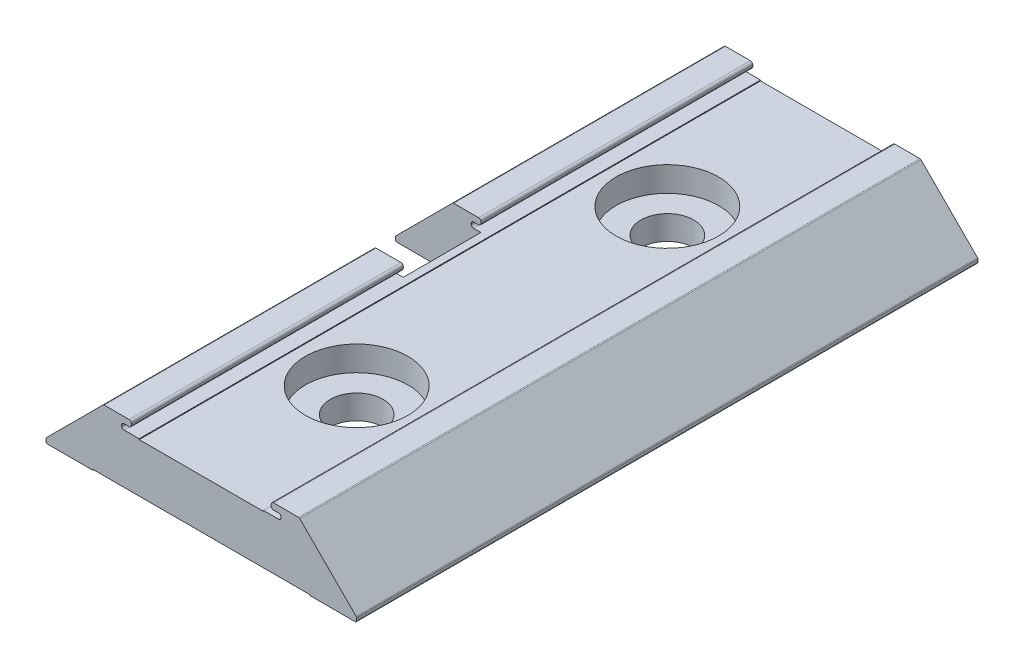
SolidWorks part; units mm, degrees
ref_plane "Front Plane" through (0, 0, 0) normal (0, 0, 1) x (1, 0, 0)
ref_plane "Top Plane" through (0, 0, 0) normal (0, 1, 0) x (1, 0, 0)
ref_plane "Right Plane" through (0, 0, 0) normal (1, 0, 0) x (0, 0, -1)
sketch "Sketch1" plane through (0, 0, 0) normal (0, 0, 1) x (1, 0, 0)
  line L0 (0.1, 0) -> (3, 0)
  line L1 (0, 0.1) -> (0, 0.2586)
  line L2 (0.0293, 0.3293) -> (3.6707, 3.9707)
  line L3 (3.7414, 4) -> (5.35, 4)
  line L4 (5.5, 3.85) -> (5.5, 3.75)
  line L5 (5.35, 3.6) -> (5.025, 3.6)
  line L6 (4.875, 3.45) -> (4.875, 3.4)
  line L7 (5.025, 3.25) -> (6, 3.25)
  line L8 (15.125, 3.4) -> (15.125, 3.45)
  line L9 (14.975, 3.6) -> (14.65, 3.6)
  line L10 (14.5, 3.75) -> (14.5, 3.85)
  line L11 (14.65, 4) -> (16.2586, 4)
  line L12 (16.3293, 3.9707) -> (19.9707, 0.3293)
  line L13 (20, 0.2586) -> (20, 0.1)
  line L14 (19.9, 0) -> (17, 0)
  line L15 (17, 0) -> (17, 0.05)
  line L16 (17, 0.05) -> (3, 0.05)
  line L17 (3, 0.05) -> (3, 0)
  line L18 (14, 3.25) -> (14.975, 3.25)
  line L19 (0, 0) -> (0.801, 0) construction
  line L20 (6, 3.25) -> (6, 3.2)
  line L21 (6, 3.2) -> (9.9, 3.2)
  line L22 (14, 3.25) -> (14, 3.2)
  line L23 (0, 0) -> (0, 0.3) construction
  line L24 (9.9, 3.2) -> (14, 3.2)
  line L25 (0, 0.3) -> (0.2634, 0.5634) construction
  arc A0 (5.025, 3.6) -> (4.875, 3.45) centre (5.025, 3.45) ccw
  arc A1 (5.025, 3.25) -> (4.875, 3.4) centre (5.025, 3.4) cw
  arc A2 (5.5, 3.75) -> (5.35, 3.6) centre (5.35, 3.75) cw
  arc A3 (5.35, 4) -> (5.5, 3.85) centre (5.35, 3.85) cw
  arc A4 (15.125, 3.4) -> (14.975, 3.25) centre (14.975, 3.4) cw
  arc A5 (14.975, 3.6) -> (15.125, 3.45) centre (14.975, 3.45) cw
  arc A6 (14.5, 3.75) -> (14.65, 3.6) centre (14.65, 3.75) ccw
  arc A7 (14.65, 4) -> (14.5, 3.85) centre (14.65, 3.85) ccw
  arc A8 (20, 0.1) -> (19.9, 0) centre (19.9, 0.1) cw
  arc A9 (19.9707, 0.3293) -> (20, 0.2586) centre (19.9, 0.2586) cw
  arc A10 (16.3293, 3.9707) -> (16.2586, 4) centre (16.2586, 3.9) ccw
  arc A11 (3.6707, 3.9707) -> (3.7414, 4) centre (3.7414, 3.9) cw
  arc A12 (0.0293, 0.3293) -> (0, 0.2586) centre (0.1, 0.2586) ccw
  arc A13 (0.1, 0) -> (0, 0.1) centre (0.1, 0.1) cw
  point P42 (20, 0)
  point P45 (20, 0.3)
  point P52 (0, 0.3)
  point P55 (0, 0)
  dimension "D17" = 0.15
  dimension "D19" = 3.2
  dimension "D24" = 0.1
  dimension "D1" = 20
  dimension "D2" = 3
  dimension "D3" = 3
  dimension "D4" = 0.3
  dimension "D5" = 0.3
  dimension "D6" = 0.05
  dimension "D7" = 4
  dimension "D8" = 4
  dimension "D9" = 10.25
  dimension "D10" = 4.875
  dimension "D11" = 0.75
  dimension "D12" = 0.35
  dimension "D13" = 0.35
  dimension "D14" = 9
  dimension "D15" = 0.625
  dimension "D16" = 135
  dimension "D18" = 4.875
  dimension "D20" = 0.625
  dimension "D21" = 8
  dimension "D22" = 6
  dimension "D23" = 0.05
extrude "Extrude1" add sketch "Sketch1" along normal blind 40
hole_wizard "CBORE for M3 Hex Socket Head Cap Screw1" positions "Sketch5" profile "Sketch4" counterbore size "M3" standard "DIN"
sketch "Sketch5" plane through (0, 3.2, 0) normal (0, 1, 0) x (-1, 0, 0)
  line L0 (-14, 0) -> (-6, 0) construction
  line L1 (0, 40) -> (0, 0) construction
  point P0 (-10, 10)
  dimension "D1" = 10
  dimension "D2" = 10
sketch "Sketch4" plane through (10, 3.2, 10) normal (1, 0, 0) x (0, 0, 1)
  line L0 (0, 0) -> (0, 3.2)
  line L1 (0, 3.2) -> (1.7, 3.2)
  line L3 (1.7, 3.2) -> (1.7, 1.6)
  line L4 (1.7, 1.6) -> (3.3, 1.6)
  line L5 (3.3, 1.6) -> (3.3, 0)
  line L7 (3.3, 0) -> (0, 0)
  line L11 (0, -6.35) -> (0, 107.95) construction
  dimension "Thru Hole Dia." = 3.4
  dimension "Thru Hole Depth" = 3.2
  dimension "C'Bore Dia." = 6.6
  dimension "C'Bore Depth" = 1.6
pattern_linear "LPattern1" count 2 spacing 20 along (0, 0, 1) of "CBORE for M3 Hex Socket Head Cap Screw1"
sketch "Sketch6" plane through (0, 0, 0) normal (-1, 0, 0) x (0, 0, 1)
  line L0 (0, 3.9707) -> (0, 0.3293) construction
  line L1 (17.5, 7.833) -> (22.5, 7.833)
  line L2 (17.5, 7.833) -> (17.5, -4.2353)
  line L3 (17.5, -4.2353) -> (22.5, -4.2353)
  line L4 (22.5, 7.833) -> (22.5, -4.2353)
  dimension "D1" = 17.5
  dimension "D2" = 5
extrude "Extrude2" cut sketch "Sketch6" against normal blind 5.5
hole_wizard "M1.6 Tapped Hole1" positions "Sketch8" profile "Sketch7" tap size "M1.6" standard "DIN"
sketch "Sketch8" plane through (5.5, 0, 0) normal (-1, 0, 0) x (0, 0, 1)
  line L0 (40, 0) -> (0, 0) construction
  line L1 (0, 3.9707) -> (0, 0.3293) construction
  point P0 (20, 1.8)
  dimension "D1" = 1.8
  dimension "D2" = 20
sketch "Sketch7" plane through (5.5, 1.8, 20) normal (0, 1, 0) x (0, 0, 1)
  line L0 (0, 0) -> (0, 6.4255)
  line L1 (0, 6.4255) -> (0.625, 6.05)
  line L2 (0.625, 6.05) -> (0.625, 0)
  line L5 (0.625, 0) -> (0, 0)
  line L10 (0, 6.4255) -> (-0.625, 6.05) construction
  line L11 (0, -6.35) -> (0, 107.95) construction
  dimension "Tap Drill Dia." = 1.25
  dimension "Tap Drill Depth" = 6.05
  dimension "Drill Angle" = 118
